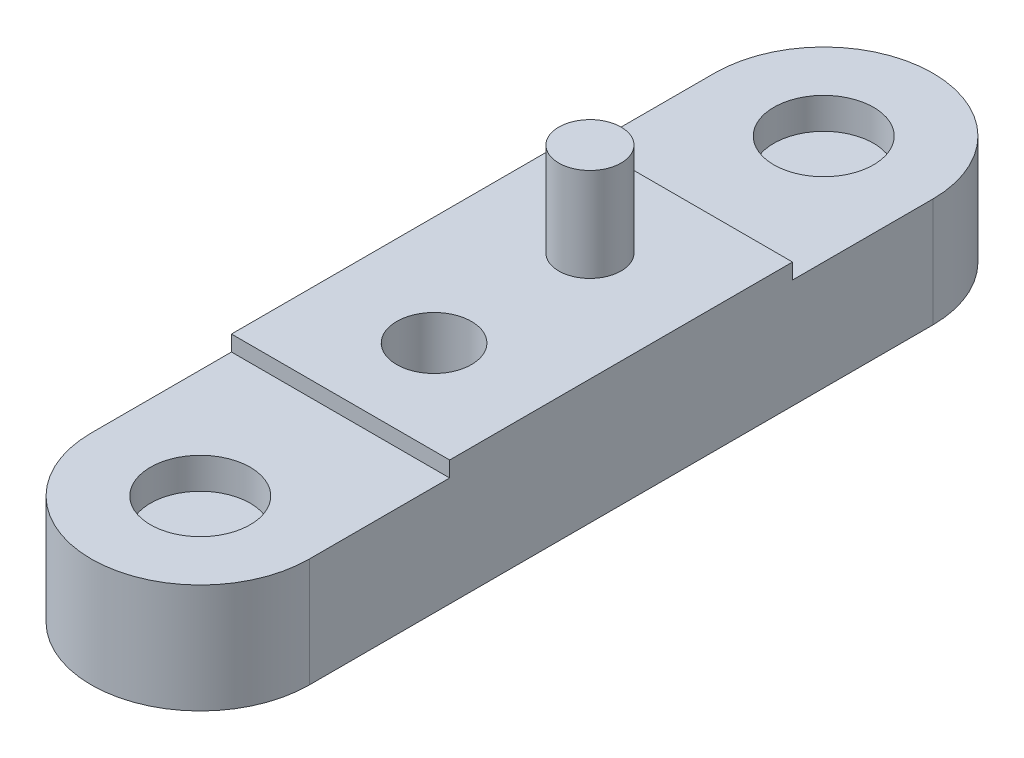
SolidWorks part; units mm, degrees
ref_plane "Front" through (0, 0, 0) normal (0, 0, 1) x (1, 0, 0)
ref_plane "Top" through (0, 0, 0) normal (0, 1, 0) x (1, 0, 0)
ref_plane "Right" through (0, 0, 0) normal (1, 0, 0) x (0, 0, -1)
sketch "Sketch1" plane through (0, 0, 0) normal (0, 1, 0) x (1, 0, 0)
  line L0 (0, 1.5) -> (-8.1896, 1.5) construction
  line L1 (0, 3.5) -> (-8.1896, 3.5) construction
  line L2 (-3.5, -10) -> (3.5, -10)
  line L3 (-3.5, 0) -> (3.5, 0) construction
  line L4 (-3.5, 0) -> (-3.5, -10)
  line L6 (3.5, 0) -> (3.5, -10)
  circle A0 centre (0, 0) radius 1.5 construction
  arc A1 (3.5, 0) -> (-3.5, 0) centre (0, 0) ccw
  dimension "D1" = 3
  dimension "D2" = 2
  dimension "D3" = 10
extrude "Boss-Extrude1" add sketch "Sketch1" along normal blind 4
sketch "Sketch2" plane through (0, 4, 0) normal (0, 1, 0) x (1, 0, 0)
  line L0 (0, 0) -> (-11.0692, 0) construction
  line L1 (-3.5, -4.5) -> (3.5, -4.5)
  line L2 (-3.5, 0) -> (-3.5, -10) construction
  line L3 (3.5, -10) -> (3.5, 0) construction
  line L4 (-3.5, 0) -> (-3.5, -4.5)
  line L5 (3.5, 0) -> (3.5, -4.5)
  line L6 (0, -3.5) -> (-8.4344, -3.5) construction
  arc A0 (3.5, 0) -> (-3.5, 0) centre (0, 0) ccw construction
  arc A1 (3.5, 0) -> (-3.5, 0) centre (0, 0) ccw
  circle A2 centre (0, 0) radius 3.5 construction
  dimension "D1" = 1
extrude "Cut-Extrude1" cut sketch "Sketch2" against normal blind 0.5
sketch "Sketch3" plane through (0, 3.5, 0) normal (0, 1, 0) x (1, 0, 0)
  circle A0 centre (0, 0) radius 1.6
  dimension "D1" = 3.2
extrude "Cut-Extrude2" cut sketch "Sketch3" against normal blind 1
mirror "Mirror1" about plane through (-3.5, 4, 10) normal (0, 0, -1)
sketch "Sketch4" plane through (0, 4, 0) normal (0, 1, 0) x (1, 0, 0)
  line L0 (0, -4.5) -> (0, -15.5) construction
  line L1 (-3.5, -4.5) -> (3.5, -4.5) construction
  line L2 (-3.5, -15.5) -> (3.5, -15.5) construction
  line L3 (0, -10) -> (-6.044, -10) construction
  circle A0 centre (0, -7.5) radius 1
  dimension "D2" = 2
  dimension "D1" = 2.5
extrude "Boss-Extrude2" add sketch "Sketch4" along normal blind 3
sketch "Sketch5" plane through (0, 4, 0) normal (0, 1, 0) x (1, 0, 0)
  line L0 (0, -4.5) -> (0, -15.5) construction
  line L1 (-3.5, -4.5) -> (3.5, -4.5) construction
  line L2 (-3.5, -15.5) -> (3.5, -15.5) construction
  line L3 (0, -10) -> (-7.1463, -10) construction
  circle A0 centre (0, -12.5) radius 1.2
  dimension "D2" = 2.4
  dimension "D1" = 2.5
extrude "Cut-Extrude3" cut sketch "Sketch5" against normal blind 4
